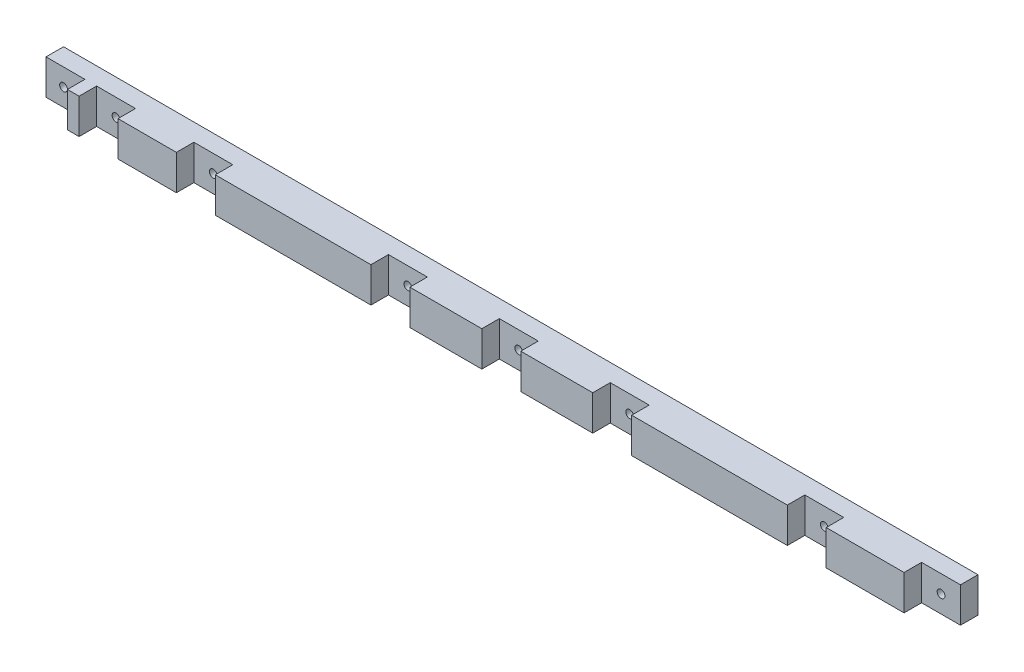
SolidWorks part; units mm, degrees
ref_plane "Plan de face" through (0, 0, 0) normal (0, 0, 1) x (1, 0, 0)
ref_plane "Plan de dessus" through (0, 0, 0) normal (0, 1, 0) x (1, 0, 0)
ref_plane "Plan de droite" through (0, 0, 0) normal (1, 0, 0) x (0, 0, -1)
sketch "Esquisse1" plane through (0, 0, 0) normal (0, 0, 1) x (1, 0, 0)
  line L1 (0, 0) -> (235, 0)
  line L2 (0, 0) -> (0, 9)
  line L3 (0, 9) -> (235, 9)
  line L4 (235, 0) -> (235, 9)
  dimension "D1" = 235
  dimension "D2" = 9
extrude "Extrusion1" add sketch "Esquisse1" along normal blind 9
sketch "Esquisse2" plane through (0, 0, 9) normal (0, 0, 1) x (1, 0, 0)
  line L0 (235, 9) -> (0, 9) construction
  line L1 (0, 0) -> (10, 0)
  line L2 (0, 0) -> (0, 9)
  line L3 (0, 9) -> (10, 9)
  line L4 (10, 0) -> (10, 9)
  dimension "D1" = 10
extrude "Enlèv. mat.-Extru.1" cut sketch "Esquisse2" against normal blind 4.5
sketch "Esquisse3" plane through (0, 0, 4.5) normal (0, 0, 1) x (1, 0, 0)
  line L0 (0, 9) -> (0, 0) construction
  line L1 (0, 0) -> (10, 0) construction
  circle A0 centre (4.5, 4.5) radius 1
  dimension "D3" = 2
  dimension "D1" = 4.5
  dimension "D2" = 4.5
extrude "Enlèv. mat.-Extru.2" cut sketch "Esquisse3" against normal blind 4.5
sketch "Esquisse4" plane through (0, 0, 9) normal (0, 0, 1) x (1, 0, 0)
  line L0 (10, 0) -> (235, 0) construction
  line L1 (13, 0) -> (23, 0)
  line L2 (13, 0) -> (13, 9)
  line L3 (13, 9) -> (23, 9)
  line L4 (23, 0) -> (23, 9)
  line L5 (235, 9) -> (10, 9) construction
  dimension "D1" = 3
  dimension "D2" = 10
extrude "Enlèv. mat.-Extru.3" cut sketch "Esquisse4" against normal blind 4.5
sketch "Esquisse5" plane through (0, 0, 4.5) normal (0, 0, 1) x (1, 0, 0)
  line L0 (13, 9) -> (13, 0) construction
  line L1 (23, 9) -> (13, 9) construction
  circle A0 centre (18, 4.5) radius 1
  point P4 (18, 9)
  dimension "D3" = 2
  dimension "D1" = 5
  dimension "D2" = 4.5
extrude "Enlèv. mat.-Extru.4" cut sketch "Esquisse5" against normal blind 4.5
sketch "Esquisse6" plane through (0, 0, 9) normal (0, 0, 1) x (1, 0, 0)
  line L0 (23, 0) -> (235, 0) construction
  line L1 (38, 0) -> (48, 0)
  line L2 (38, 0) -> (38, 9)
  line L3 (38, 9) -> (48, 9)
  line L4 (48, 0) -> (48, 9)
  line L5 (235, 9) -> (23, 9) construction
  dimension "D1" = 15
  dimension "D2" = 10
extrude "Enlèv. mat.-Extru.5" cut sketch "Esquisse6" against normal blind 4.5
sketch "Esquisse7" plane through (0, 0, 4.5) normal (0, 0, 1) x (1, 0, 0)
  line L0 (38, 9) -> (38, 0) construction
  line L1 (38, 0) -> (48, 0) construction
  circle A0 centre (43, 4.5) radius 1
  point P4 (43, 0)
  dimension "D3" = 2
  dimension "D1" = 5
  dimension "D2" = 4.5
extrude "Enlèv. mat.-Extru.6" cut sketch "Esquisse7" against normal blind 4.5
sketch "Esquisse8" plane through (0, 0, 9) normal (0, 0, 1) x (1, 0, 0)
  line L0 (48, 0) -> (235, 0) construction
  line L1 (88, 0) -> (98, 0)
  line L2 (88, 0) -> (88, 9)
  line L3 (88, 9) -> (98, 9)
  line L4 (98, 0) -> (98, 9)
  line L5 (235, 9) -> (48, 9) construction
  dimension "D1" = 40
  dimension "D2" = 10
extrude "Enlèv. mat.-Extru.7" cut sketch "Esquisse8" against normal blind 4.5
sketch "Esquisse9" plane through (0, 0, 4.5) normal (0, 0, 1) x (1, 0, 0)
  line L0 (88, 9) -> (88, 0) construction
  line L1 (98, 9) -> (88, 9) construction
  circle A0 centre (93, 4.5) radius 1
  point P4 (93, 9)
  dimension "D3" = 2
  dimension "D1" = 5
  dimension "D2" = 4.5
extrude "Enlèv. mat.-Extru.8" cut sketch "Esquisse9" against normal blind 4.5
sketch "Esquisse10" plane through (0, 0, 9) normal (0, 0, 1) x (1, 0, 0)
  line L0 (98, 0) -> (235, 0) construction
  line L1 (116.5, 0) -> (126.5, 0)
  line L2 (116.5, 0) -> (116.5, 9)
  line L3 (116.5, 9) -> (126.5, 9)
  line L4 (126.5, 0) -> (126.5, 9)
  line L5 (235, 9) -> (98, 9) construction
  dimension "D1" = 10
  dimension "D2" = 18.5
extrude "Enlèv. mat.-Extru.9" cut sketch "Esquisse10" against normal blind 4.5
sketch "Esquisse11" plane through (0, 0, 4.5) normal (0, 0, 1) x (1, 0, 0)
  line L0 (116.5, 9) -> (116.5, 0) construction
  line L1 (126.5, 9) -> (116.5, 9) construction
  circle A0 centre (121.5, 4.5) radius 1
  point P2 (116.5, 4.5)
  dimension "D3" = 2
  dimension "D1" = 5
  dimension "D2" = 4.5
extrude "Enlèv. mat.-Extru.10" cut sketch "Esquisse11" against normal blind 4.5
sketch "Esquisse12" plane through (0, 0, 9) normal (0, 0, 1) x (1, 0, 0)
  line L0 (126.5, 0) -> (235, 0) construction
  line L1 (145, 0) -> (155, 0)
  line L2 (145, 0) -> (145, 9)
  line L3 (145, 9) -> (155, 9)
  line L4 (155, 0) -> (155, 9)
  line L5 (235, 9) -> (126.5, 9) construction
  dimension "D1" = 10
  dimension "D2" = 18.5
extrude "Enlèv. mat.-Extru.11" cut sketch "Esquisse12" against normal blind 4.5
sketch "Esquisse13" plane through (0, 0, 4.5) normal (0, 0, 1) x (1, 0, 0)
  line L0 (145, 9) -> (145, 0) construction
  line L1 (145, 0) -> (155, 0) construction
  circle A0 centre (150, 4.5) radius 1
  point P2 (145, 4.5)
  point P5 (150, 0)
  dimension "D3" = 2
  dimension "D1" = 5
  dimension "D2" = 4.5
extrude "Enlèv. mat.-Extru.12" cut sketch "Esquisse13" against normal blind 4.5
sketch "Esquisse14" plane through (0, 0, 9) normal (0, 0, 1) x (1, 0, 0)
  line L0 (155, 0) -> (235, 0) construction
  line L1 (195, 0) -> (205, 0)
  line L2 (195, 0) -> (195, 9)
  line L3 (195, 9) -> (205, 9)
  line L4 (205, 0) -> (205, 9)
  line L5 (235, 9) -> (155, 9) construction
  dimension "D1" = 10
  dimension "D2" = 40
extrude "Enlèv. mat.-Extru.13" cut sketch "Esquisse14" against normal blind 4.5
sketch "Esquisse15" plane through (0, 0, 4.5) normal (0, 0, 1) x (1, 0, 0)
  line L0 (195, 9) -> (195, 0) construction
  line L1 (195, 0) -> (205, 0) construction
  circle A0 centre (200, 4.5) radius 1
  point P4 (200, 0)
  dimension "D3" = 2
  dimension "D1" = 5
  dimension "D2" = 4.5
extrude "Enlèv. mat.-Extru.14" cut sketch "Esquisse15" against normal blind 4.5
sketch "Esquisse16" plane through (0, 0, 9) normal (0, 0, 1) x (1, 0, 0)
  line L0 (205, 0) -> (235, 0) construction
  line L1 (235, 9) -> (225, 9)
  line L2 (235, 9) -> (235, 0)
  line L3 (235, 0) -> (225, 0)
  line L4 (225, 9) -> (225, 0)
  dimension "D1" = 10
extrude "Enlèv. mat.-Extru.15" cut sketch "Esquisse16" against normal blind 4.5
sketch "Esquisse17" plane through (0, 0, 4.5) normal (0, 0, 1) x (1, 0, 0)
  line L0 (225, 9) -> (225, 0) construction
  line L1 (235, 9) -> (225, 9) construction
  circle A0 centre (230, 4.5) radius 1
  point P2 (225, 4.5)
  dimension "D3" = 2
  dimension "D1" = 5
  dimension "D2" = 4.5
extrude "Enlèv. mat.-Extru.16" cut sketch "Esquisse17" against normal blind 4.5
